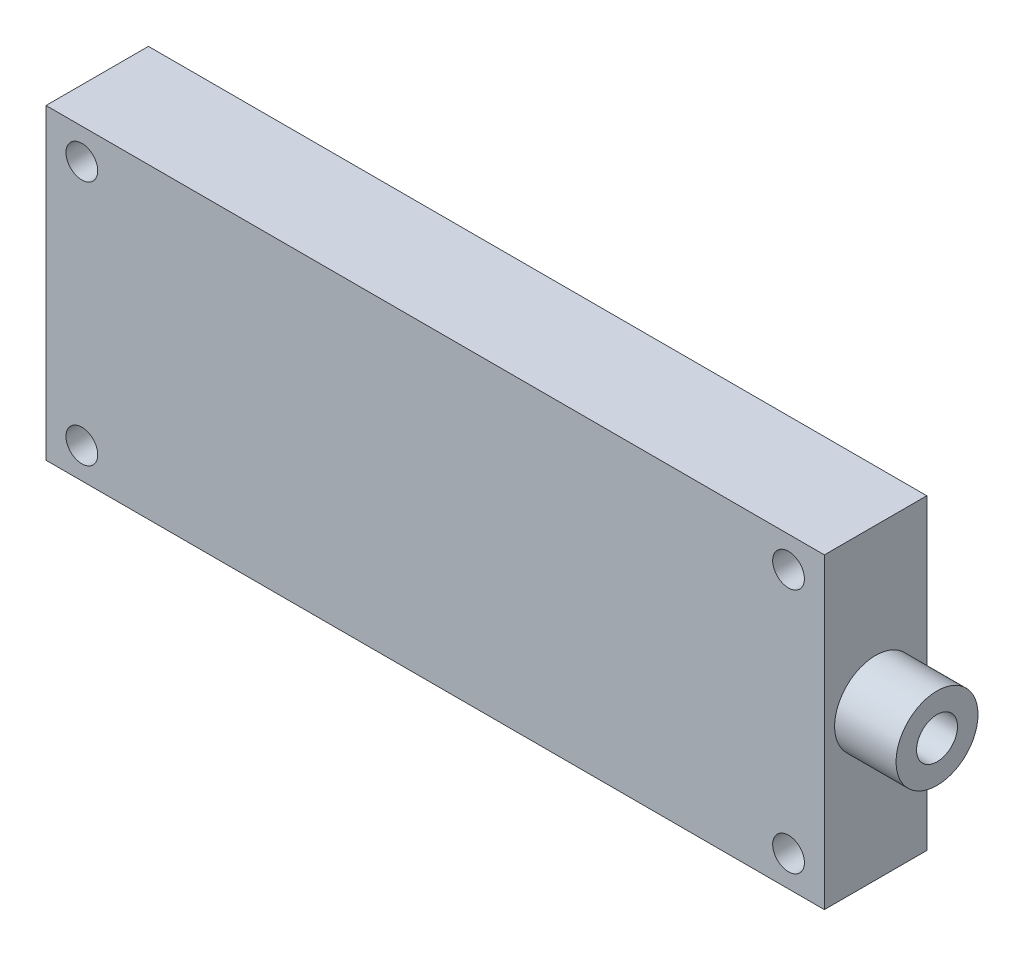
SolidWorks part; units mm, degrees
ref_plane "前视基准面" through (0, 0, 0) normal (0, 0, 1) x (1, 0, 0)
ref_plane "上视基准面" through (0, 0, 0) normal (0, 1, 0) x (1, 0, 0)
ref_plane "右视基准面" through (0, 0, 0) normal (1, 0, 0) x (0, 0, -1)
sketch "草图1" plane through (0, 0, 0) normal (0, 0, 1) x (1, 0, 0)
  line L0 (0, 63.6735) -> (0, -57.2449) construction
  line L1 (-66.7347, 0) -> (114.7959, 0) construction
  line L3 (0, 30) -> (76, 30)
  line L4 (0, 30) -> (0, 0)
  line L5 (0, 0) -> (76, 0)
  line L6 (76, 30) -> (76, 0)
  dimension "D1" = 30
  dimension "D2" = 76
extrude "凸台-拉伸1" add sketch "草图1" along normal blind 10
sketch "草图2" plane through (0, 0, 10) normal (0, 0, 1) x (1, 0, 0)
  line L0 (3.5, 46.2412) -> (3.5, -12.163) construction
  line L1 (72.5, 47.3537) -> (72.5, -12.163) construction
  line L2 (0, 15) -> (76, 15) construction
  line L3 (0, 30) -> (0, 0) construction
  line L4 (76, 0) -> (76, 30) construction
  line L5 (76, 30) -> (0, 30) construction
  line L6 (0, 0) -> (76, 0) construction
  circle A2 centre (3.5, 27) radius 1.55
  circle A3 centre (3.5, 3) radius 1.55
  circle A4 centre (72.5, 3) radius 1.55
  circle A5 centre (72.5, 27) radius 1.55
  dimension "D3" = 3.1
  dimension "D4" = 3.1
  dimension "D5" = 3.1
  dimension "D6" = 3.1
  dimension "D1" = 3.5
  dimension "D2" = 3.5
  dimension "D7" = 3
  dimension "D8" = 3
extrude "切除-拉伸1" cut sketch "草图2" against normal blind 3
sketch "草图3" plane through (76, 0, 0) normal (1, 0, 0) x (0, 0, -1)
  line L0 (-10, 15) -> (0, 15) construction
  line L1 (-10, 0) -> (-10, 30) construction
  line L2 (0, 0) -> (0, 30) construction
  line L3 (-5, 30) -> (-5, 0) construction
  line L4 (-10, 30) -> (0, 30) construction
  line L5 (-10, 0) -> (0, 0) construction
  circle A0 centre (-5, 15) radius 4
  dimension "D1" = 8
extrude "凸台-拉伸2" add sketch "草图3" along normal blind 6
sketch "草图4" plane through (82, 0, 0) normal (1, 0, 0) x (0, 0, -1)
  line L0 (-10, 15) -> (0, 15) construction
  line L1 (-10, 0) -> (-10, 30) construction
  line L2 (0, 0) -> (0, 30) construction
  line L4 (-10, 30) -> (0, 30) construction
  line L5 (-5, 30) -> (-5, 0) construction
  line L6 (-10, 0) -> (0, 0) construction
  circle A0 centre (-5, 15) radius 2
  dimension "D1" = 4
extrude "切除-拉伸2" cut sketch "草图4" against normal blind 1.5
sketch "草图5" plane through (80.5, 0, 0) normal (1, 0, 0) x (0, 0, -1)
  line L0 (-5, 15) -> (-5, 30.9815) construction
  line L1 (-5, 30.9815) -> (-5, -2.0708) construction
  line L2 (-10, 15) -> (0, 15) construction
  line L3 (-10, 0) -> (-10, 30) construction
  line L4 (0, 0) -> (0, 30) construction
  line L5 (-6.3229, 16.5) -> (-3.6771, 16.5)
  circle A0 centre (-5, 15) radius 2 construction
  arc A1 (-6.3229, 16.5) -> (-3.6771, 16.5) centre (-5, 15) ccw
  dimension "D1" = 1.5
extrude "切除-拉伸3" cut sketch "草图5" against normal blind 7 contours L5 M3
